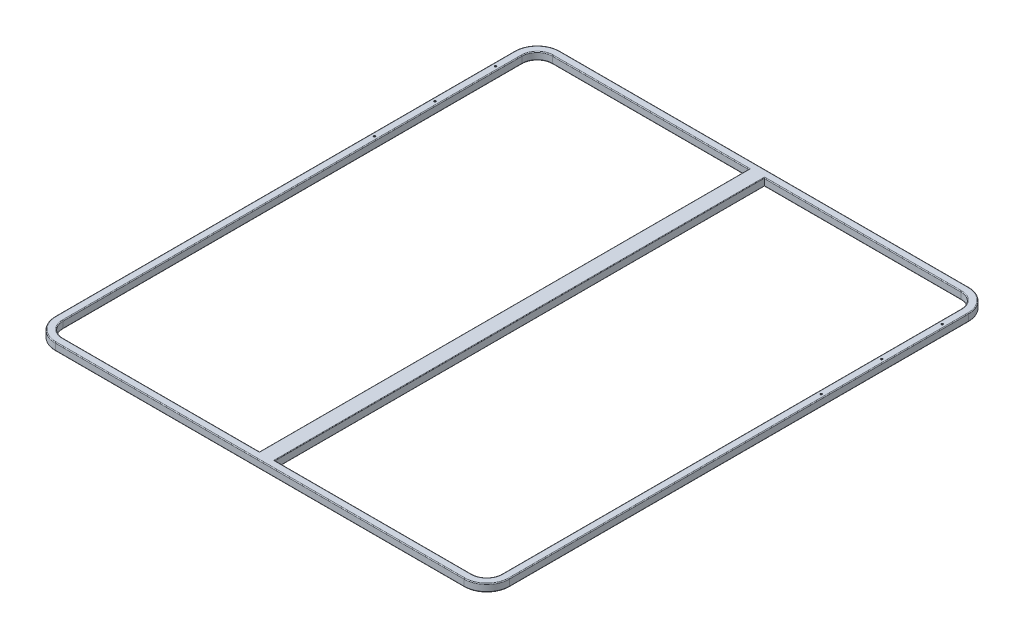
SolidWorks part; units mm, degrees
ref_plane "Спереди" through (0, 0, 0) normal (0, 0, 1) x (1, 0, 0)
ref_plane "Сверху" through (0, 0, 0) normal (0, 1, 0) x (1, 0, 0)
ref_plane "Справа" through (0, 0, 0) normal (1, 0, 0) x (0, 0, -1)
sketch "Эскиз1" plane through (0, 0, 0) normal (0, 1, 0) x (1, 0, 0)
  line L0 (0, -1000) -> (0, 1000) construction
  line L1 (-810, -1000) -> (810, -1000)
  line L2 (-900, -910) -> (-900, 910)
  line L3 (-810, 1000) -> (810, 1000)
  line L4 (900, -910) -> (900, 910)
  line L5 (-810, -970) -> (810, -970)
  line L6 (870, -910) -> (870, 910)
  line L7 (-810, 970) -> (810, 970)
  line L8 (-870, -910) -> (-870, 910)
  line L13 (-810, 970) -> (810, 970) construction
  line L15 (-810, -970) -> (810, -970) construction
  arc A0 (-900, -910) -> (-810, -1000) centre (-810, -910) ccw
  arc A1 (810, -1000) -> (900, -910) centre (810, -910) ccw
  arc A2 (900, 910) -> (810, 1000) centre (810, 910) ccw
  arc A3 (-810, 1000) -> (-900, 910) centre (-810, 910) ccw
  arc A4 (810, -970) -> (870, -910) centre (810, -910) ccw
  arc A5 (870, 910) -> (810, 970) centre (810, 910) ccw
  arc A6 (-810, 970) -> (-870, 910) centre (-810, 910) ccw
  arc A7 (-870, -910) -> (-810, -970) centre (-810, -910) ccw
  point P9 (-900, -1000)
  point P12 (900, -1000)
  point P17 (-900, 1000)
  point P30 (0, 0)
  dimension "D3" = 90
  dimension "D1" = 1800
  dimension "D2" = 2000
  dimension "D4" = 30
extrude "Бобышка-Вытянуть1" add sketch "Эскиз1" along normal blind 30
sketch "Эскиз2" plane through (0, 30, 0) normal (0, 1, 0) x (1, 0, 0)
  line L0 (-900, 820) -> (-870, 820) construction
  line L1 (-900, 910) -> (-900, -910) construction
  line L2 (-870, 910) -> (-870, -910) construction
  line L3 (-885, 820) -> (-885, 340) construction
  line L4 (810, 1000) -> (-810, 1000) construction
  circle A0 centre (-885, 820) radius 3.75
  circle A1 centre (-885, 580) radius 3.75
  circle A2 centre (-885, 340) radius 3.75
  dimension "D2" = 7.5
  dimension "D4" = 180
  dimension "D5" = 480
extrude "Вырез-Вытянуть1" cut sketch "Эскиз2" against normal through all
ref_plane "Плоскость1" through (0, 0, 0) normal (-1, 0, 0) x (0, 0, 1)
mirror "Зеркальное отражение1" about plane through (0, 0, 0) normal (1, 0, 0) of "Вырез-Вытянуть1"
fillet "Скругление1" radius 3 32 edges at (852.4264, 30, 952.4264) (870, 30, 0) (852.4264, 30, -952.4264) (0, 30, 970) (-852.4264, 30, 952.4264) (-870, 30, 0) (-852.4264, 30, -952.4264) (852.4264, 0, 952.4264) (852.4264, 0, -952.4264) (0, 0, 970) (-852.4264, 0, 952.4264) (-870, 0, 0) (-852.4264, 0, -952.4264) (873.6396, 30, -973.6396) (900, 30, 0) (873.6396, 30, 973.6396) (0, 30, 1000) (-873.6396, 30, 973.6396) (-900, 30, 0) (-873.6396, 30, -973.6396) (873.6396, 0, -973.6396) (900, 0, 0) (873.6396, 0, 973.6396) (0, 0, 1000) (-873.6396, 0, 973.6396) (-900, 0, 0) (-873.6396, 0, -973.6396) (0, 30, -970) (870, 0, 0) (0, 0, -970) (0, 30, -1000) (0, 0, -1000)
shell "Оболочка2" thickness 2
sketch "Эскиз3" plane through (0, 0, -970) normal (0, 0, 1) x (1, 0, 0)
  line L0 (0, 30) -> (0, 0) construction
  line L1 (-28, 30) -> (28, 30)
  line L2 (-30, 28) -> (-30, 2)
  line L3 (-28, 0) -> (28, 0)
  line L5 (-810, 30) -> (810, 30) construction
  line L6 (-810, 30) -> (810, 30) construction
  line L7 (-810, 0) -> (810, 0) construction
  line L9 (30, 28) -> (30, 2)
  line L11 (0, 30) -> (0, 0) construction
  line L13 (28, 28) -> (28, 2)
  line L17 (28, 2) -> (-28, 2)
  line L18 (-28, 2) -> (-28, 28)
  line L19 (-28, 28) -> (28, 28)
  arc A2 (-30, 2) -> (-28, 0) centre (-28, 2) ccw
  arc A3 (-28, 30) -> (-30, 28) centre (-28, 28) ccw
  arc A4 (28, 30) -> (30, 28) centre (28, 28) cw
  arc A5 (30, 2) -> (28, 0) centre (28, 2) cw
  dimension "D1" = 2
  dimension "D2" = 30
extrude "Бобышка-Вытянуть2" add sketch "Эскиз3" along normal up to vertex (1943 mm away) and the other way up to vertex (3 mm away)
